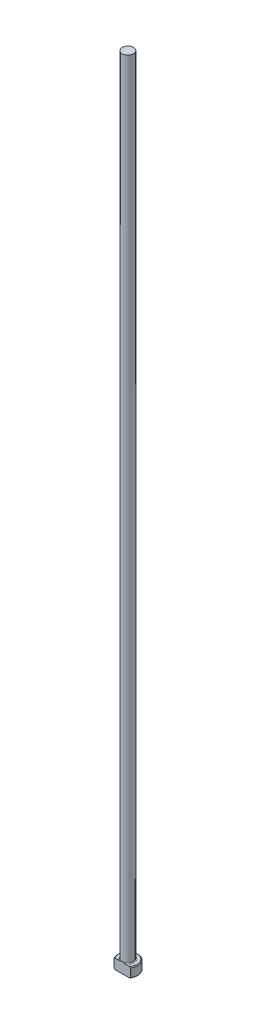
SolidWorks part; units mm, degrees
ref_plane "Front Plane" through (0, 0, 0) normal (0, 0, 1) x (1, 0, 0)
ref_plane "Top Plane" through (0, 0, 0) normal (0, 1, 0) x (1, 0, 0)
ref_plane "Right Plane" through (0, 0, 0) normal (1, 0, 0) x (0, 0, -1)
sketch "Sketch1" plane through (0, 0, 0) normal (0, 0, 1) x (1, 0, 0)
  line L0 (0, 259.9588) -> (0, -15.1925) construction
  line L1 (0, 0) -> (-3.175, 0)
  line L2 (-3.175, 0) -> (-3.175, 3.175)
  line L3 (-3.175, 3.175) -> (-1.7856, 3.175)
  line L4 (-1.7856, 3.175) -> (-1.7856, 254)
  line L5 (-1.7856, 254) -> (0, 254)
  line L6 (0, 254) -> (0, 0)
  dimension "L" = 254
  dimension "H" = 6.35
  dimension "T" = 3.175
  dimension "D" = 3.5712
revolve "Revolve1" add sketch "Sketch1" angle 360 about L0
chamfer "Chamfer1" distance 0.254 angle 45 2 edges at (0, 3.175, 3.175) (0, 0, 3.175)
fillet "Fillet1" radius 0.254 1 edges at (0, 3.175, 1.7856)
sketch "Sketch2" plane through (0, 0, 0) normal (0, 1, 0) x (1, 0, 0)
  line L0 (-2.6253, -1.7856) -> (2.6253, -1.7856)
  circle A0 centre (0, 0) radius 3.175 construction
  arc A1 (-2.6253, -1.7856) -> (2.6253, -1.7856) centre (0, 0) ccw
  circle A3 centre (0, 0) radius 1.7856 construction
  dimension "D1" = 0
extrude "Key" cut sketch "Sketch2" along normal through all
sketch "Pocket Sketch" plane through (0, 0, 0) normal (0, 0, 1) x (1, 0, 0)
  line L0 (-3.5719, 0) -> (-3.5719, 3.2004)
  line L1 (-3.5719, 3.2004) -> (-2.7461, 3.2004)
  line L2 (-1.9841, 3.9624) -> (-1.9841, 22.225)
  line L3 (-1.9841, 22.225) -> (0, 22.225)
  line L4 (0, 22.225) -> (0, 0)
  line L5 (0, 0) -> (-3.5719, 0)
  line L6 (0, 12.6104) -> (0, -2.4989) construction
  line L7 (-3.175, 2.921) -> (-3.175, 0.254) construction
  line L8 (2.921, 3.175) -> (-2.921, 3.175) construction
  line L9 (-1.7856, 254) -> (-1.7856, 3.429) construction
  line L10 (-2.7461, 3.2004) -> (-1.9841, 3.9624)
  point P3 (-1.9841, 3.2004)
  dimension "D1" = 7.1437
  dimension "D2" = 0.3969
  dimension "D3" = 0.0254
  dimension "D4" = 0.1984
  dimension "D5" = 3.9681
  dimension "D6" = 22.225
